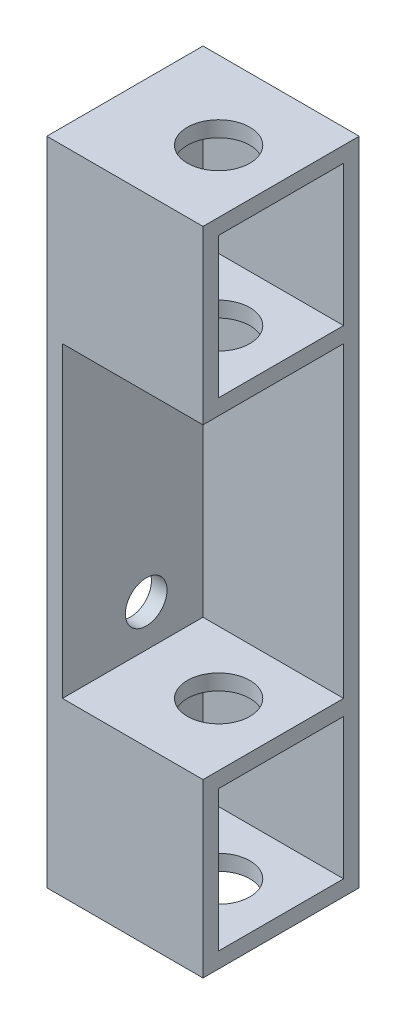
SolidWorks part; units mm, degrees
ref_plane "Front Plane" through (0, 0, 0) normal (0, 0, 1) x (1, 0, 0)
ref_plane "Top Plane" through (0, 0, 0) normal (0, 1, 0) x (1, 0, 0)
ref_plane "Right Plane" through (0, 0, 0) normal (1, 0, 0) x (0, 0, -1)
ref_plane "Plane1" through (-15, 0, 0) normal (1, 0, 0) x (0, 0, -1)
sketch "Sketch2" plane through (-15, 0, 0) normal (1, 0, 0) x (0, 0, -1)
  line L1 (-15, 62.5) -> (15, 62.5)
  line L2 (-15, 62.5) -> (-15, -62.5)
  line L3 (-15, -62.5) -> (15, -62.5)
  line L4 (15, 62.5) -> (15, -62.5)
  line L5 (-15, 62.5) -> (15, -62.5) construction
  line L6 (-15, -62.5) -> (15, 62.5) construction
  point P0 (0, 0)
  dimension "D1" = 30
  dimension "D2" = 125
extrude "Boss-Extrude1" add sketch "Sketch2" along normal blind 3
sketch "Sketch3" plane through (-12, 0, 0) normal (1, 0, 0) x (0, 0, -1)
  line L0 (-15, -62.5) -> (15, -62.5) construction
  line L1 (15, 62.5) -> (12, 62.5)
  line L2 (15, 62.5) -> (15, -62.5)
  line L3 (15, -62.5) -> (12, -62.5)
  line L4 (12, 62.5) -> (12, -62.5)
  dimension "D1" = 3
extrude "Boss-Extrude2" add sketch "Sketch3" along normal blind 27
sketch "Sketch4" plane through (0, 62.5, 0) normal (0, 1, 0) x (1, 0, 0)
  line L0 (15, 15) -> (15, 12) construction
  line L1 (-15, 15) -> (15, 15)
  line L2 (-15, 15) -> (-15, -15)
  line L3 (-15, -15) -> (15, -15)
  line L4 (15, 15) -> (15, -15)
  line L5 (-12, -15) -> (-15, -15) construction
extrude "Boss-Extrude3" add sketch "Sketch4" against normal blind 3
sketch "Sketch5" plane through (0, 0, 15) normal (0, 0, 1) x (1, 0, 0)
  line L1 (15, 62.5) -> (-15, 62.5)
  line L2 (15, 62.5) -> (15, 32.5)
  line L3 (15, 32.5) -> (-15, 32.5)
  line L4 (-15, 62.5) -> (-15, 32.5)
  line L5 (-15, 62.5) -> (-15, -62.5) construction
  line L7 (-15, -62.5) -> (15, -62.5)
  line L8 (-15, -62.5) -> (-15, -32.5)
  line L9 (-15, -32.5) -> (15, -32.5)
  line L10 (15, -62.5) -> (15, -32.5)
  dimension "D1" = 30
extrude "Boss-Extrude4" add sketch "Sketch5" against normal blind 3
sketch "Sketch6" plane through (0, -62.5, 0) normal (0, -1, 0) x (1, 0, 0)
  line L1 (15, 15) -> (-15, 15)
  line L2 (15, 15) -> (15, -15)
  line L3 (15, -15) -> (-15, -15)
  line L4 (-15, 15) -> (-15, -15)
extrude "Boss-Extrude5" add sketch "Sketch6" against normal blind 3
sketch "Sketch7" plane through (0, -32.5, 0) normal (0, 1, 0) x (1, 0, 0)
  line L0 (15, -12) -> (15, -15) construction
  line L1 (15, -15) -> (-12, -15)
  line L2 (15, -15) -> (15, 12)
  line L3 (15, 12) -> (-12, 12)
  line L4 (-12, -15) -> (-12, 12)
  line L5 (15, -15) -> (-12, -15) construction
  line L6 (-12, 12) -> (15, 12) construction
extrude "Boss-Extrude6" add sketch "Sketch7" along normal blind 3
sketch "Sketch8" plane through (0, 32.5, 0) normal (0, -1, 0) x (1, 0, 0)
  line L0 (-12, -12) -> (-12, 15) construction
  line L1 (15, 15) -> (-12, 15)
  line L2 (15, 15) -> (15, -12)
  line L3 (15, -12) -> (-12, -12)
  line L4 (-12, 15) -> (-12, -12)
  line L5 (15, -12) -> (-12, -12) construction
extrude "Boss-Extrude7" add sketch "Sketch8" along normal blind 3
sketch "Sketch9" plane through (0, 62.5, 0) normal (0, 1, 0) x (1, 0, 0)
  line L0 (0, 0) -> (3, 0) construction
  circle A0 centre (3, 0) radius 6
  point P3 (0, 0)
  dimension "D1" = 12
  dimension "D2" = 3
extrude "Cut-Extrude1" cut sketch "Sketch9" along direction (0, 1, 0) on the side against the normal through all
sketch "Sketch10" plane through (-12, 0, 0) normal (1, 0, 0) x (0, 0, -1)
  line L0 (-15, 29.5) -> (12, 29.5) construction
  line L1 (1.5, -29.5) -> (-1.5, 29.5) construction
  line L2 (12, -29.5) -> (-15, -29.5) construction
  circle A0 centre (1.0932, -21.5) radius 4
  circle A1 centre (-1.0932, 21.5) radius 4
  point P4 (0, 0)
  point P12 (0, 6.1654)
  point P13 (0, 0)
  point P14 (30.9125, -48.1504)
  point P15 (-1.5, 24.5)
  point P16 (-7.1416, 24.5)
  point P17 (-4.8301, -19.2438)
  point P18 (0, 0)
  dimension "D2" = 8
  dimension "D1" = 8
  dimension "D3" = 8
extrude "Cut-Extrude2" cut sketch "Sketch10" against normal blind 3
